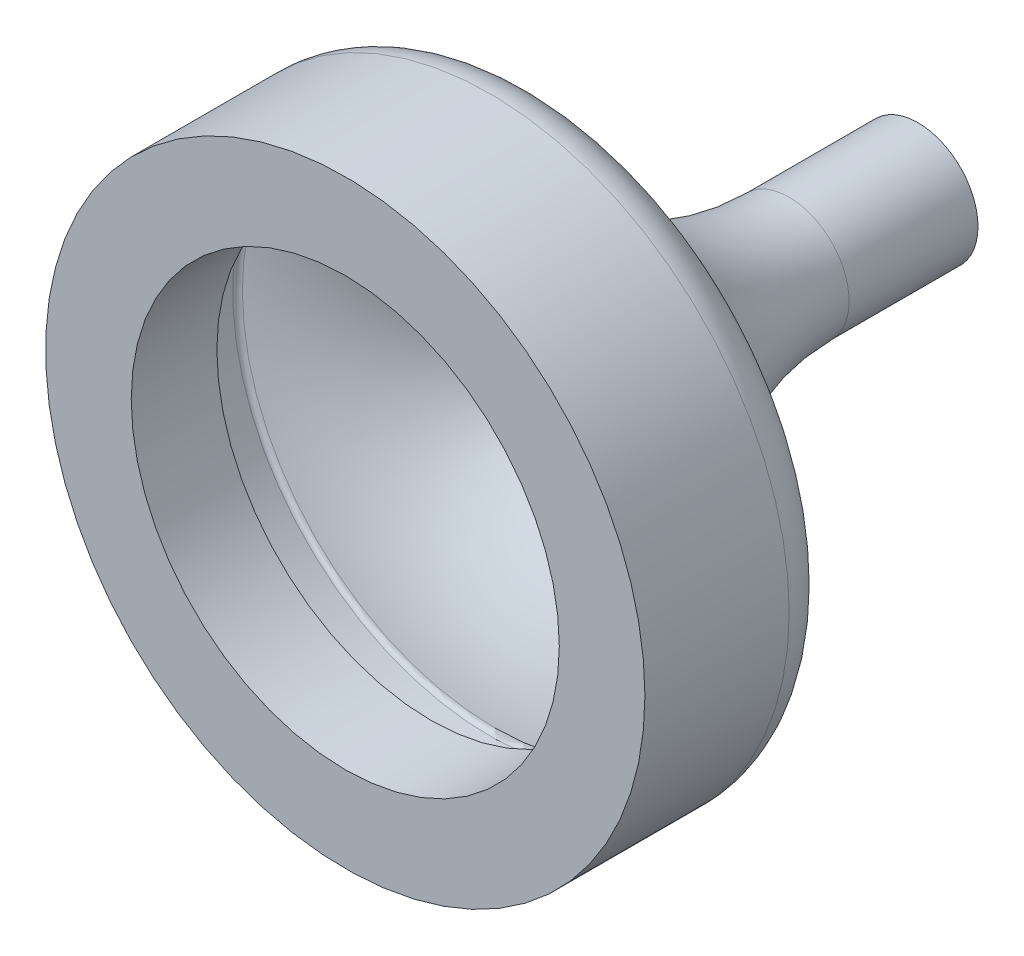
SolidWorks part; units mm, degrees
ref_plane "Plan de face" through (0, 0, 0) normal (0, 0, 1) x (1, 0, 0)
ref_plane "Plan de dessus" through (0, 0, 0) normal (0, 1, 0) x (1, 0, 0)
ref_plane "Plan de droite" through (0, 0, 0) normal (1, 0, 0) x (0, 0, -1)
sketch "Esquisse1" plane through (0, 0, 0) normal (0, 0, 1) x (1, 0, 0)
  circle A0 centre (0, 0) radius 17.5
  circle A1 centre (0, 0) radius 12.5
  dimension "D1" = 25
  dimension "D2" = 35
extrude "Extrusion1" add sketch "Esquisse1" along normal blind 5
sketch "Esquisse2" plane through (0, 0, 0) normal (0, 1, 0) x (1, 0, 0)
  line L0 (-17.5, 0) -> (-17.5, 3.4258)
  line L1 (17.5, 0) -> (-17.5, 0) construction
  line L2 (-15, 3.4258) -> (-15, 0)
  line L3 (0, 0) -> (0, 55.7321) construction
  line L4 (-3.5, 20.9211) -> (-3.5, 28.45)
  line L6 (-3.5, 28.45) -> (-1, 28.45)
  line L7 (-3.5, 27.45) -> (-3.5, 7.7721) construction
  line L8 (-15, 0) -> (-17.5, 0)
  line L9 (-1, 28.45) -> (-1, 20.9211)
  line L10 (-15, 0) -> (-15, 3.4258) construction
  line L11 (-3.5, 28.45) -> (-3.5, 20.9211) construction
  arc A0 (-15.2982, 6.1774) -> (-3.5, 20.9211) centre (-18.6114, 20.9211) ccw
  arc A1 (-15.2982, 6.1774) -> (-17.5, 3.4258) centre (-14.6798, 3.4258) ccw
  arc A2 (-14.75, 3.7382) -> (-15, 3.4258) centre (-14.6798, 3.4258) ccw
  arc A3 (-14.75, 3.7382) -> (-1, 20.9211) centre (-18.6114, 20.9211) ccw
  dimension "D1" = 17.5
  dimension "D3" = 2.5
revolve "Révolution1" add sketch "Esquisse2" angle 360 about L3
